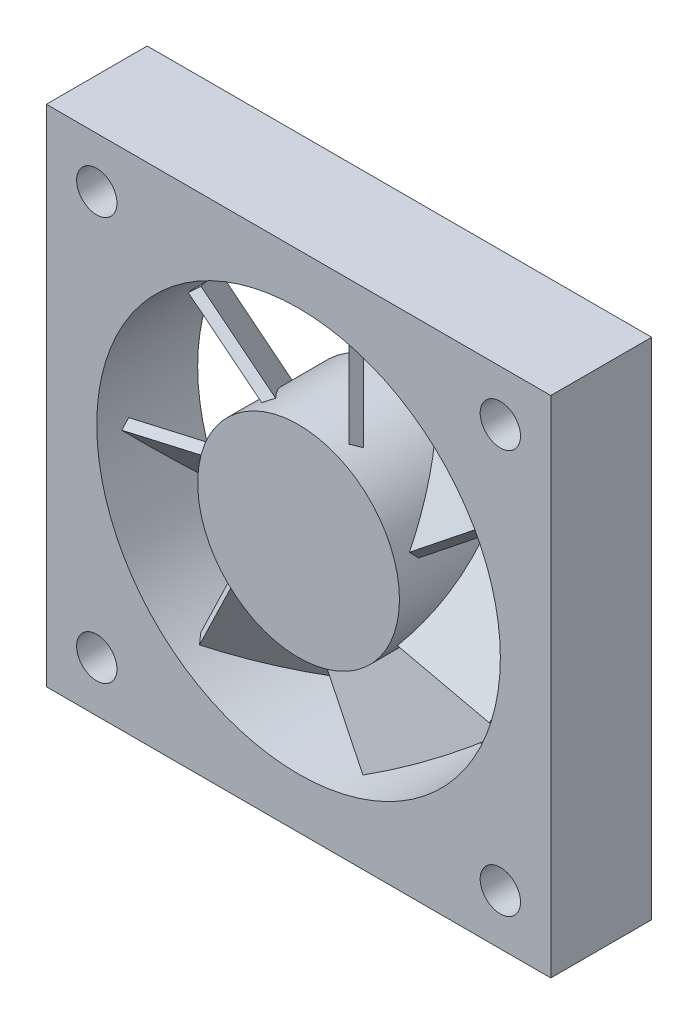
SolidWorks part; units mm, degrees
ref_plane "Plan de face" through (0, 0, 0) normal (0, 0, 1) x (1, 0, 0)
ref_plane "Plan de dessus" through (0, 0, 0) normal (0, 1, 0) x (1, 0, 0)
ref_plane "Plan de droite" through (0, 0, 0) normal (1, 0, 0) x (0, 0, -1)
sketch "Esquisse1" plane through (0, 0, 0) normal (0, 0, 1) x (1, 0, 0)
  line L0 (-25, -25) -> (25, 25) construction
  line L1 (-25, 25) -> (25, 25)
  line L2 (-25, 25) -> (-25, -25)
  line L3 (-25, -25) -> (25, -25)
  line L4 (25, 25) -> (25, -25)
  line L5 (-25, 25) -> (25, -25) construction
  line L6 (-20, 20) -> (-20, -20) construction
  line L7 (-20, -20) -> (20, -20) construction
  line L8 (20, -20) -> (20, 20) construction
  line L9 (20, 20) -> (-20, 20) construction
  circle A0 centre (0, 0) radius 20
  circle A1 centre (0, 0) radius 10
  circle A2 centre (-20, 20) radius 2
  circle A3 centre (20, 20) radius 2
  circle A4 centre (20, -20) radius 2
  circle A5 centre (-20, -20) radius 2
  dimension "D2" = 20
  dimension "D4" = 4
  dimension "D1" = 50
  dimension "D3" = 40
extrude "Boss.-Extru.1" add sketch "Esquisse1" along normal blind 10 contours L4 L1 L2 L3 A5 A4 A3 A2 A0 | A1
sketch "Esquisse2" plane through (0, 0, 0) normal (0, 1, 0) x (1, 0, 0)
  line L0 (-3.5355, -1.4645) -> (3.5355, -8.5355)
  line L1 (3.5355, -8.5355) -> (4.2426, -7.8284)
  line L2 (4.2426, -7.8284) -> (-2.8284, -0.7574)
  line L3 (-2.8284, -0.7574) -> (-3.5355, -1.4645)
  line L4 (0, 0) -> (0, -5) construction
  dimension "D1" = 45
  dimension "D2" = 10
  dimension "D3" = 5
  dimension "D4" = 1
extrude "Boss.-Extru.2" add sketch "Esquisse2" along normal offset from surface (18.5203 mm away) 1
pattern_circular "Répétition circulaire1" count 7 over 360 about axis through (0, 0, 0) along (0, 0, 1) of "Boss.-Extru.2"
